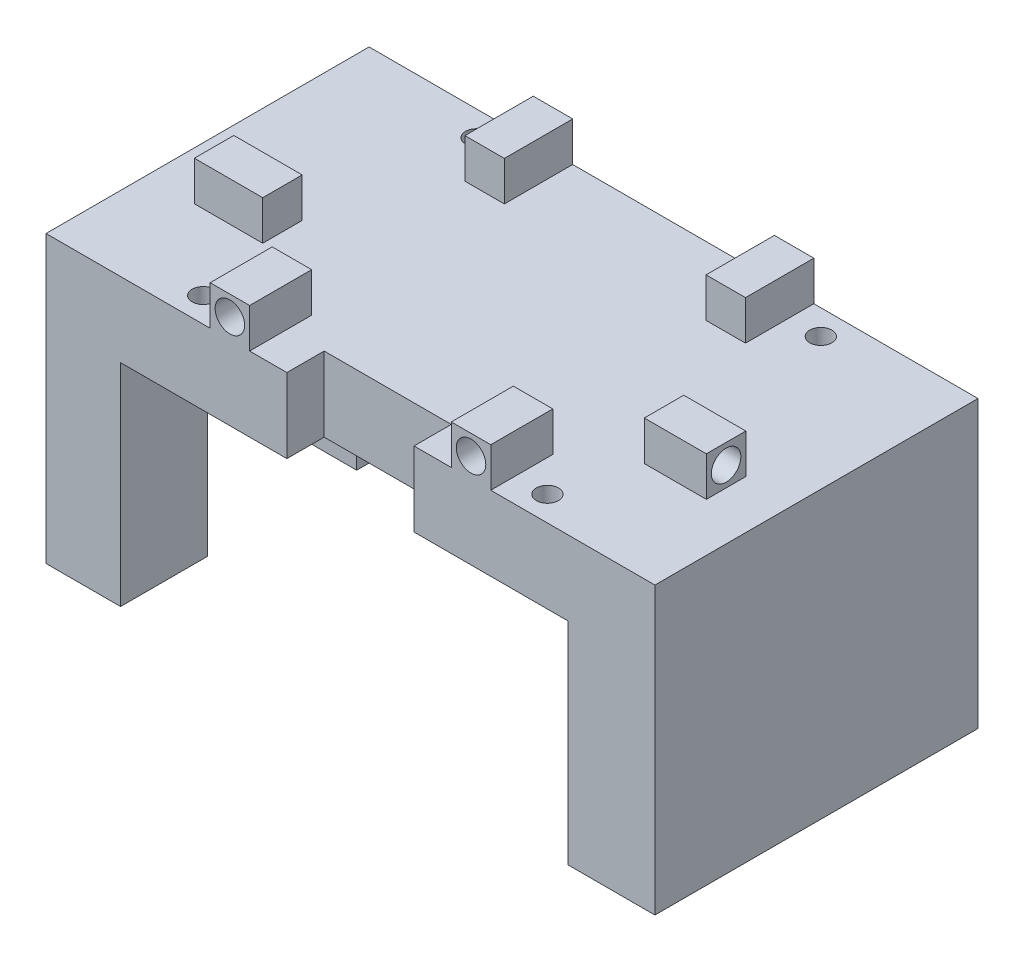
SolidWorks part; units mm, degrees
ref_plane "Front Plane" through (0, 0, 0) normal (0, 0, 1) x (1, 0, 0)
ref_plane "Top Plane" through (0, 0, 0) normal (0, 1, 0) x (1, 0, 0)
ref_plane "Right Plane" through (0, 0, 0) normal (1, 0, 0) x (0, 0, -1)
sketch "Sketch1" plane through (0, 0, 0) normal (0, 1, 0) x (1, 0, 0)
  line L1 (0, 0) -> (49, 0)
  line L2 (0, 0) -> (0, 26)
  line L3 (0, 26) -> (49, 26)
  line L4 (49, 0) -> (49, 26)
  dimension "D1" = 26
  dimension "D2" = 49
extrude "Boss-Extrude1" add sketch "Sketch1" against normal blind 6
sketch "Sketch2" plane through (0, -6, 0) normal (0, -1, 0) x (-1, 0, 0)
  line L0 (-49, 26) -> (0, 26) construction
  line L1 (0, 0) -> (-6, 0)
  line L2 (0, 0) -> (0, 7)
  line L3 (0, 7) -> (-6, 7)
  line L4 (-6, 0) -> (-6, 7)
  line L5 (0, 26) -> (-6, 26)
  line L6 (0, 26) -> (0, 19)
  line L7 (0, 19) -> (-6, 19)
  line L8 (-6, 26) -> (-6, 19)
  line L9 (-49, 0) -> (-42, 0)
  line L10 (-49, 0) -> (-49, 26)
  line L11 (-49, 26) -> (-42, 26)
  line L12 (-42, 0) -> (-42, 26)
  line L13 (0, 0) -> (-49, 0) construction
  line L14 (0, 26) -> (0, 0) construction
  dimension "D1" = 7
  dimension "D2" = 6
  dimension "D3" = 7
  dimension "D4" = 7
  dimension "D5" = 6
extrude "Boss-Extrude2" add sketch "Sketch2" along normal blind 17
sketch "Sketch4" plane through (0, 0, 0) normal (0, 1, 0) x (1, 0, 0)
  line L0 (0, 0) -> (49, 0) construction
  line L1 (9.4, 20.5) -> (39.6, 20.5)
  line L2 (9.4, 20.5) -> (9.4, 5.5)
  line L3 (9.4, 5.5) -> (39.6, 5.5)
  line L4 (39.6, 20.5) -> (39.6, 5.5)
  line L5 (0, 26) -> (0, 0) construction
  dimension "D1" = 5.5
  dimension "D2" = 9.4
  dimension "D3" = 30.2
sketch "Sketch6" plane through (0, 0, 0) normal (0, 1, 0) x (1, 0, 0)
  line L0 (9.4, 5.5) -> (39.6, 5.5) construction
  line L1 (13.21, 4.992) -> (16.385, 4.992)
  line L2 (13.21, 4.992) -> (13.21, 0)
  line L3 (13.21, 0) -> (16.385, 0)
  line L4 (16.385, 4.992) -> (16.385, 0)
  line L5 (32.615, 4.992) -> (35.79, 4.992)
  line L6 (32.615, 4.992) -> (32.615, 0)
  line L7 (32.615, 0) -> (35.79, 0)
  line L8 (35.79, 4.992) -> (35.79, 0)
  line L9 (40.108, 8.04) -> (45.1, 8.04)
  line L10 (40.108, 8.04) -> (40.108, 11.215)
  line L11 (40.108, 11.215) -> (45.1, 11.215)
  line L12 (45.1, 8.04) -> (45.1, 11.215)
  line L13 (9.4, 20.5) -> (9.4, 5.5) construction
  line L14 (39.6, 20.5) -> (39.6, 5.5) construction
  line L15 (9.4, 20.5) -> (39.6, 20.5) construction
  line L16 (49, 26) -> (0, 26) construction
  line L17 (35.79, 26) -> (32.615, 26)
  line L18 (35.79, 26) -> (35.79, 20.5)
  line L19 (35.79, 20.5) -> (32.615, 20.5)
  line L20 (32.615, 26) -> (32.615, 20.5)
  line L21 (0, 0) -> (49, 0) construction
  line L22 (16.385, 26) -> (13.21, 26)
  line L23 (16.385, 26) -> (16.385, 20.5)
  line L24 (16.385, 20.5) -> (13.21, 20.5)
  line L25 (13.21, 26) -> (13.21, 20.5)
  line L26 (9.4, 11.215) -> (3.9, 11.215)
  line L27 (9.4, 11.215) -> (9.4, 8.04)
  line L28 (9.4, 8.04) -> (3.9, 8.04)
  line L29 (3.9, 11.215) -> (3.9, 8.04)
  dimension "D1" = 0.508
  dimension "D3" = 3.81
  dimension "D4" = 3.175
  dimension "D5" = 3.81
  dimension "D6" = 0.508
  dimension "D7" = 0.508
  dimension "D8" = 2.54
  dimension "D9" = 0
  dimension "D10" = 0
extrude "Boss-Extrude3" add sketch "Sketch6" along normal blind 3.175
sketch "Detents 2" plane through (0, 0, 0) normal (0, 0, 1) x (1, 0, 0)
  line L0 (13.21, 3.175) -> (16.385, 3.175) construction
  line L1 (16.385, 3.175) -> (16.385, 0) construction
  line L2 (32.615, 3.175) -> (35.79, 3.175) construction
  line L4 (32.615, 3.175) -> (32.615, 0) construction
  circle A0 centre (14.7975, 1.5875) radius 0.823
  circle A1 centre (34.2025, 1.5875) radius 1.0287
  dimension "D1" = 1.5875
  dimension "D2" = 1.5875
  dimension "D3" = 1.5875
  dimension "D4" = 1.5875
hole_wizard "Tap Drill for #4-48 Tap1" positions "Sketch9" profile "Sketch8" hole size "#4-48" standard "ANSI Inch"
sketch "Sketch9" plane through (0, 0, 0) normal (0, 0, 1) x (1, 0, 0)
  point P0 (14.7975, 1.5875)
  point P4 (34.2025, 1.5875)
sketch "Sketch8" plane through (14.7975, 1.5875, 0) normal (1, 0, 0) x (0, -1, 0)
  line L0 (0, 0) -> (0, 15.7135)
  line L1 (0, 15.7135) -> (1.1874, 15)
  line L2 (1.1874, 15) -> (1.1874, 0)
  line L5 (1.1874, 0) -> (0, 0)
  line L10 (0, 15.7135) -> (-1.1875, 15) construction
  line L11 (0, -6.35) -> (0, 107.95) construction
  dimension "Hole Dia." = 2.3749
  dimension "Hole Depth" = 15
  dimension "Drill Angle" = 118
sketch "Detents" plane through (45.1, 0, 0) normal (1, 0, 0) x (0, 0, -1)
  line L0 (11.215, 3.175) -> (11.215, 0) construction
  line L1 (8.04, 3.175) -> (11.215, 3.175) construction
  circle A0 centre (9.6275, 1.5875) radius 0.8647
  dimension "D1" = 1.5875
  dimension "D2" = 1.5875
hole_wizard "Tap Drill for #4-48 Tap2" positions "3DSketch1" profile "Sketch11" hole size "#4-48" standard "ANSI Inch"
sketch3d "3DSketch1"
  point P0 (45.1, 1.5875, -9.6275)
sketch "Sketch11" plane through (45.1, 1.5875, -9.6275) normal (0, 1, 0) x (0, 0, -1)
  line L0 (0, 0) -> (0, 20.7135)
  line L1 (0, 20.7135) -> (1.1874, 20)
  line L2 (1.1874, 20) -> (1.1874, 0)
  line L5 (1.1874, 0) -> (0, 0)
  line L10 (0, 20.7135) -> (-1.1875, 20) construction
  line L11 (0, -6.35) -> (0, 107.95) construction
  dimension "Hole Dia." = 2.3749
  dimension "Hole Depth" = 20
  dimension "Drill Angle" = 118
sketch "Sketch23" plane through (0, 0, 0) normal (0, 1, 0) x (1, 0, 0)
  line L0 (0, 0) -> (13.21, 0) construction
  line L1 (19.385, 0) -> (29.615, 0)
  line L2 (19.385, 0) -> (19.385, 3)
  line L3 (19.385, 3) -> (29.615, 3)
  line L4 (29.615, 0) -> (29.615, 3)
  line L5 (32.615, 4.992) -> (32.615, 0) construction
  line L6 (16.385, 0) -> (16.385, 4.992) construction
  dimension "D1" = 3
  dimension "D2" = 3
  dimension "D3" = 3
extrude "Cut-Extrude1" cut sketch "Sketch23" against normal through all contours L3 L4 L1 L2
sketch "Metrology Plate Attachments" plane through (0, -23, 0) normal (0, -1, 0) x (1, 0, 0)
  line L0 (0, -26) -> (6, -26) construction
  line L1 (3, -22.5) -> (45.5, -22.5)
  line L2 (3, -22.5) -> (3, -3.5)
  line L3 (3, -3.5) -> (45.5, -3.5)
  line L4 (45.5, -22.5) -> (45.5, -3.5)
  line L5 (3, -16.5) -> (45.5, -16.5)
  line L6 (3, -16.5) -> (3, -10.5)
  line L7 (3, -10.5) -> (45.5, -10.5)
  line L8 (45.5, -16.5) -> (45.5, -10.5)
  line L9 (0, -19) -> (0, -26) construction
  dimension "D1" = 3.5
  dimension "D2" = 3
  dimension "D3" = 19
  dimension "D4" = 42.5
  dimension "D5" = 6
  dimension "D6" = 7
hole_wizard "Tap Drill for #4-40 Tap1" positions "Sketch26" profile "Sketch25" hole size "#4-40" standard "ANSI Inch"
sketch "Sketch26" plane through (0, -23, 0) normal (0, -1, 0) x (-1, 0, 0)
  point P0 (-45.5, 3.5)
  point P3 (-45.5, 22.5)
  point P6 (-3, 22.5)
  point P9 (-3, 3.5)
sketch "Sketch25" plane through (45.5, -23, -3.5) normal (1, 0, 0) x (0, 0, -1)
  line L0 (0, 0) -> (0, 13.3792)
  line L1 (0, 13.3792) -> (1.1303, 12.7)
  line L2 (1.1303, 12.7) -> (1.1303, 0)
  line L5 (1.1303, 0) -> (0, 0)
  line L10 (0, 13.3792) -> (-1.1303, 12.7) construction
  line L11 (0, -6.35) -> (0, 107.95) construction
  dimension "Hole Dia." = 2.2606
  dimension "Hole Depth" = 12.7
  dimension "Drill Angle" = 118
hole_wizard "1/8 (0.1250) Dowel Hole1" positions "Sketch28" profile "Sketch27" hole size "1/8" standard "ANSI Inch"
sketch "Sketch28" plane through (0, -23, 0) normal (0, -1, 0) x (-1, 0, 0)
  point P0 (-45.5, 10.5)
  point P3 (-45.5, 16.5)
sketch "Sketch27" plane through (45.5, -23, -10.5) normal (1, 0, 0) x (0, 0, -1)
  line L0 (0, 0) -> (0, 7.3039)
  line L1 (0, 7.3039) -> (1.5875, 6.35)
  line L2 (1.5875, 6.35) -> (1.5875, 0)
  line L5 (1.5875, 0) -> (0, 0)
  line L10 (0, 7.3039) -> (-1.5875, 6.35) construction
  line L11 (0, -6.35) -> (0, 107.95) construction
  dimension "Hole Dia." = 3.175
  dimension "Hole Depth" = 6.35
  dimension "Drill Angle" = 118
sketch "Posts" plane through (0, 0, 0) normal (0, 1, 0) x (1, 0, 0)
  line L0 (0, 26) -> (0, 0) construction
  line L1 (10.65, 2) -> (38.35, 2)
  line L2 (10.65, 2) -> (10.65, 24)
  line L3 (10.65, 24) -> (38.35, 24)
  line L4 (38.35, 2) -> (38.35, 24)
  line L5 (0, 0) -> (13.21, 0) construction
  line L6 (13.21, 26) -> (0, 26) construction
  dimension "D1" = 10.65
  dimension "D2" = 2
  dimension "D3" = 2
  dimension "D4" = 27.7
hole_wizard "Tap Drill for #2-56 Tap1" positions "Sketch31" profile "Sketch30" hole size "#2-56" standard "ANSI Inch"
sketch "Sketch31" plane through (0, 0, 0) normal (0, 1, 0) x (1, 0, 0)
  point P0 (10.65, 2)
  point P3 (38.35, 2)
  point P6 (38.35, 24)
  point P9 (10.65, 24)
sketch "Sketch30" plane through (10.65, 0, -2) normal (1, 0, 0) x (0, 0, 1)
  line L0 (0, 0) -> (0, 23)
  line L1 (0, 23) -> (0.889, 23)
  line L2 (0.889, 23) -> (0.889, 0)
  line L5 (0.889, 0) -> (0, 0)
  line L11 (0, -6.35) -> (0, 107.95) construction
  dimension "Thru Hole Dia." = 1.778
  dimension "Thru Hole Depth" = 23
